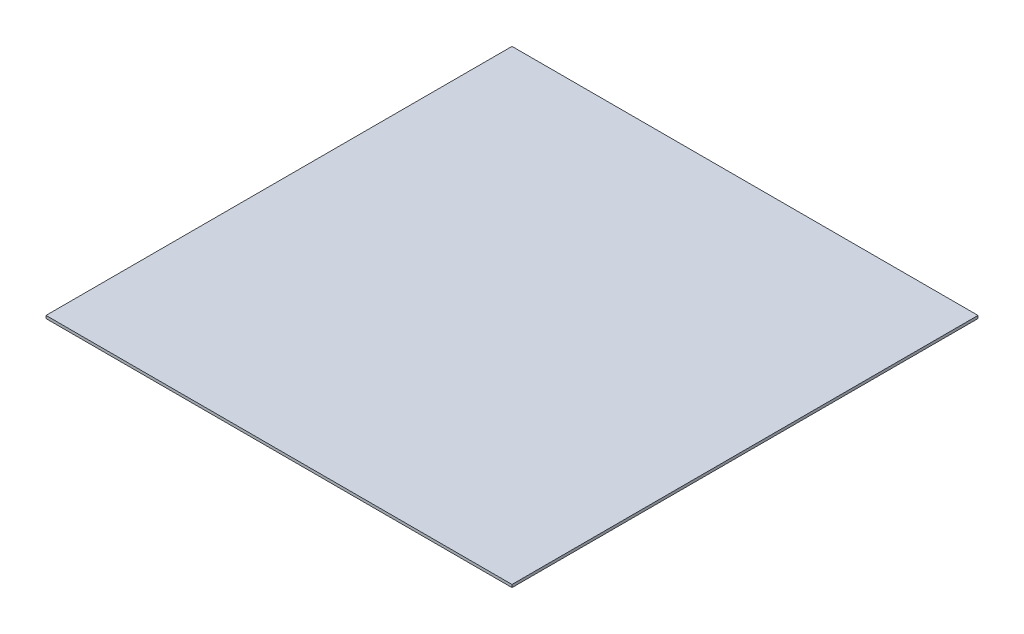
SolidWorks part; units mm, degrees
ref_plane "Front Plane" through (0, 0, 0) normal (0, 0, 1) x (1, 0, 0)
ref_plane "Top Plane" through (0, 0, 0) normal (0, 1, 0) x (1, 0, 0)
ref_plane "Right Plane" through (0, 0, 0) normal (1, 0, 0) x (0, 0, -1)
sketch "Sketch1" plane through (0, 0, 0) normal (0, 1, 0) x (1, 0, 0)
  line L1 (-533.4, 533.4) -> (533.4, 533.4)
  line L2 (-533.4, 533.4) -> (-533.4, -533.4)
  line L3 (-533.4, -533.4) -> (533.4, -533.4)
  line L4 (533.4, 533.4) -> (533.4, -533.4)
  line L5 (-533.4, 533.4) -> (533.4, -533.4) construction
  line L6 (-533.4, -533.4) -> (533.4, 533.4) construction
  point P0 (0, 0)
  dimension "D1" = 1066.8
extrude "Boss-Extrude1" add sketch "Sketch1" along normal blind 6.35
sketch "Sketch2" plane through (0, 6.35, 0) normal (0, 1, 0) x (1, 0, 0)
  line L1 (-127, 127) -> (127, 127)
  line L2 (-127, 127) -> (-127, -127)
  line L3 (-127, -127) -> (127, -127)
  line L4 (127, 127) -> (127, -127)
  line L5 (-127, 127) -> (127, -127) construction
  line L6 (-127, -127) -> (127, 127) construction
  point P0 (0, 0)
  dimension "D1" = 254
extrude "Cut-Extrude1" [suppressed] cut sketch "Sketch2" against normal through all
